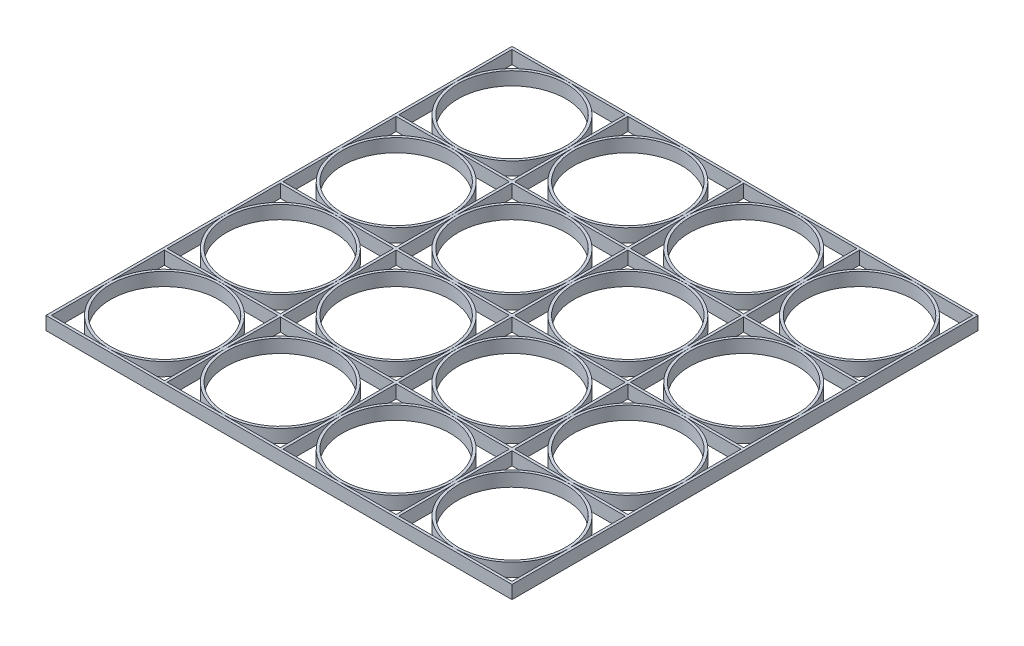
SolidWorks part; units mm, degrees
ref_plane "Front Plane" through (0, 0, 0) normal (0, 0, 1) x (1, 0, 0)
ref_plane "Top Plane" through (0, 0, 0) normal (0, 1, 0) x (1, 0, 0)
ref_plane "Right Plane" through (0, 0, 0) normal (1, 0, 0) x (0, 0, -1)
sketch "Sketch1" plane through (0, 0, 0) normal (0, 1, 0) x (1, 0, 0)
  line L1 (-21.9375, 21.9375) -> (21.9375, 21.9375)
  line L2 (-21.9375, 21.9375) -> (-21.9375, -21.9375)
  line L3 (-21.9375, -21.9375) -> (21.9375, -21.9375)
  line L4 (21.9375, 21.9375) -> (21.9375, -21.9375)
  line L5 (-21.9375, 21.9375) -> (21.9375, -21.9375) construction
  line L6 (-21.9375, -21.9375) -> (21.9375, 21.9375) construction
  line L7 (-21.4375, 21.4375) -> (21.4375, 21.4375)
  line L8 (-21.4375, 21.4375) -> (-21.4375, -21.4375)
  line L9 (-21.4375, -21.4375) -> (21.4375, -21.4375)
  line L10 (21.4375, 21.4375) -> (21.4375, -21.4375)
  line L11 (-21.4375, 21.4375) -> (21.4375, -21.4375) construction
  line L12 (-21.4375, -21.4375) -> (21.4375, 21.4375) construction
  point P0 (0, 0)
  point P6 (0, 0)
  dimension "D1" = 43.875
  dimension "D2" = 0.5
extrude "Boss-Extrude1" add sketch "Sketch1" along normal blind 5
sketch "Sketch2" plane through (0, 0, 0) normal (0, 1, 0) x (1, 0, 0)
  line L0 (-21.4375, 21.4375) -> (-21.4375, -21.4375) construction
  line L1 (21.4375, -21.4375) -> (21.4375, 21.4375) construction
  circle A0 centre (0, 0) radius 21.4375
  circle A1 centre (0, 0) radius 20.4375
  dimension "D1" = 1
extrude "Boss-Extrude2" add sketch "Sketch2" along normal blind 5 separate body
pattern_linear "LPattern2" count 4 spacing 43.875 along (1, 0, 0)
pattern_linear "LPattern3" count 4 spacing 43.875 along (0, 0, 1)
sketch "Sketch3" plane through (0, 0, 0) normal (0, 1, 0) x (1, 0, 0)
  line L1 (-21.9375, 21.9375) -> (153.5625, 21.9375)
  line L2 (-21.9375, 21.9375) -> (-21.9375, -153.5625)
  line L3 (-21.9375, -153.5625) -> (153.5625, -153.5625)
  line L4 (153.5625, 21.9375) -> (153.5625, -153.5625)
  line L5 (153.5625, -21.9375) -> (153.5625, 21.9375) construction
  line L6 (-21.9375, 21.9375) -> (-21.9375, -21.9375) construction
  line L8 (21.9375, -153.5625) -> (65.8125, -153.5625) construction
  line L10 (65.8125, 21.9375) -> (21.9375, 21.9375) construction
extrude "Extrude-Thin1" add sketch "Sketch3" along normal blind 5 thin
